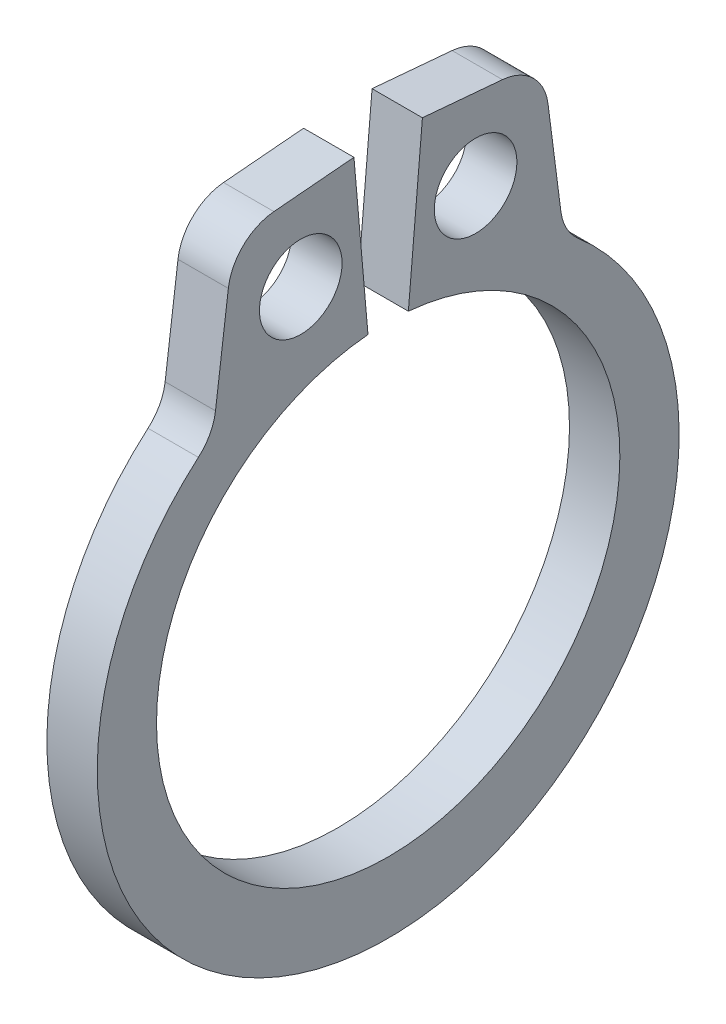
SolidWorks part; units mm, degrees
ref_plane "Front" through (0, 0, 0) normal (0, 0, 1) x (1, 0, 0)
ref_plane "Top" through (0, 0, 0) normal (0, 1, 0) x (1, 0, 0)
ref_plane "Right" through (0, 0, 0) normal (1, 0, 0) x (0, 0, -1)
sketch "Sketch1" plane through (0, 0, 0) normal (1, 0, 0) x (0, 0, -1)
  line L0 (0, 0) -> (0, 2.921) construction
  line L1 (-0.2546, 2.9099) -> (-0.4317, 4.9342)
  line L2 (0.4317, 4.9342) -> (1.9499, 4.8013)
  line L3 (1.9499, 4.8013) -> (2.2098, 2.786)
  line L4 (0.2546, 2.9099) -> (0.4317, 4.9342)
  line L5 (-0.4317, 4.9342) -> (-1.9499, 4.8013)
  line L6 (-1.9499, 4.8013) -> (-2.2098, 2.786)
  line L7 (-2.2098, 2.786) -> (-1.8152, 2.2885) construction
  line L8 (2.2098, 2.786) -> (1.8152, 2.2885) construction
  line L9 (0, -2.921) -> (0, -3.81) construction
  line L10 (-1.9499, 4.8013) -> (-0.2546, 2.9099) construction
  line L11 (0, 2.921) -> (0, 4.953) construction
  line L12 (-2.921, 0) -> (2.921, 0) construction
  circle A0 centre (0, 0) radius 2.921 construction
  arc A1 (-0.2546, 2.9099) -> (0.2546, 2.9099) centre (0, 0) ccw
  circle A3 centre (0, 0) radius 5.461 construction
  circle A4 centre (-1.1022, 3.8556) radius 0.5207
  circle A5 centre (1.1022, 3.8556) radius 0.5207
  arc A6 (-2.2098, 2.786) -> (2.2098, 2.786) centre (0, -0.1418) ccw
  point P0 (0, -3.81)
  dimension "A" = 5.842
  dimension "D2" = 1.524
  dimension "L" = 10.922
  dimension "Hole" = 1.0414
  dimension "Smin" = 0.635
  dimension "Smax" = 0.889
  dimension "H" = 2.032
  dimension "Angle" = 5
extrude "Extrude1" add sketch "Sketch1" along normal mid plane 0.635
fillet "Fillet1" radius 0.635 4 edges at (0, 2.786, 2.2098) (0, 2.786, -2.2098) (0, 4.8013, 1.9499) (0, 4.8013, -1.9499)
sketch "Sketch2" plane through (0, 0, 0) normal (0, 0, 1) x (1, 0, 0)
  line L0 (-3.5433, 0) -> (9.1567, 0)
  line L1 (9.1567, 0) -> (9.1567, -3.175)
  line L2 (-0.3683, -3.175) -> (-3.2893, -3.175)
  line L3 (9.1567, -3.175) -> (0.3683, -3.175)
  line L4 (0.3683, -3.175) -> (0.3683, -2.921)
  line L5 (0.3683, -2.921) -> (-0.3683, -2.921)
  line L6 (-0.3683, -2.921) -> (-0.3683, -3.175)
  line L7 (-0.3683, -3.175) -> (-3.5433, -3.175) construction
  line L8 (-3.5433, -3.175) -> (-3.5433, 0) construction
  line L9 (9.1567, 0) -> (76.391, 0) construction
  line L10 (-3.2893, -3.175) -> (-3.5433, -2.921)
  line L11 (-3.5433, -2.921) -> (-3.5433, 0)
  point P10 (0, -2.921)
  dimension "D1" = 45
  dimension "Dg" = 5.842
  dimension "Ds" = 6.35
  dimension "W" = 0.7366
  dimension "D2" = 12.7
  dimension "D3" = 3.175
revolve "Revolve1" [suppressed] add sketch "Sketch2" angle 360 about L9
delete or keep bodies "Body-Delete1" [suppressed] type delete bodies bodies 122
equation "\"D2@Sketch2\" = \"D1@Extrude1\"*20"
equation "\"D3@Sketch2\" = \"D2@Sketch2\"/4"
equation "\"D2@Sketch1\" = \"H@Sketch1\"*.75"
